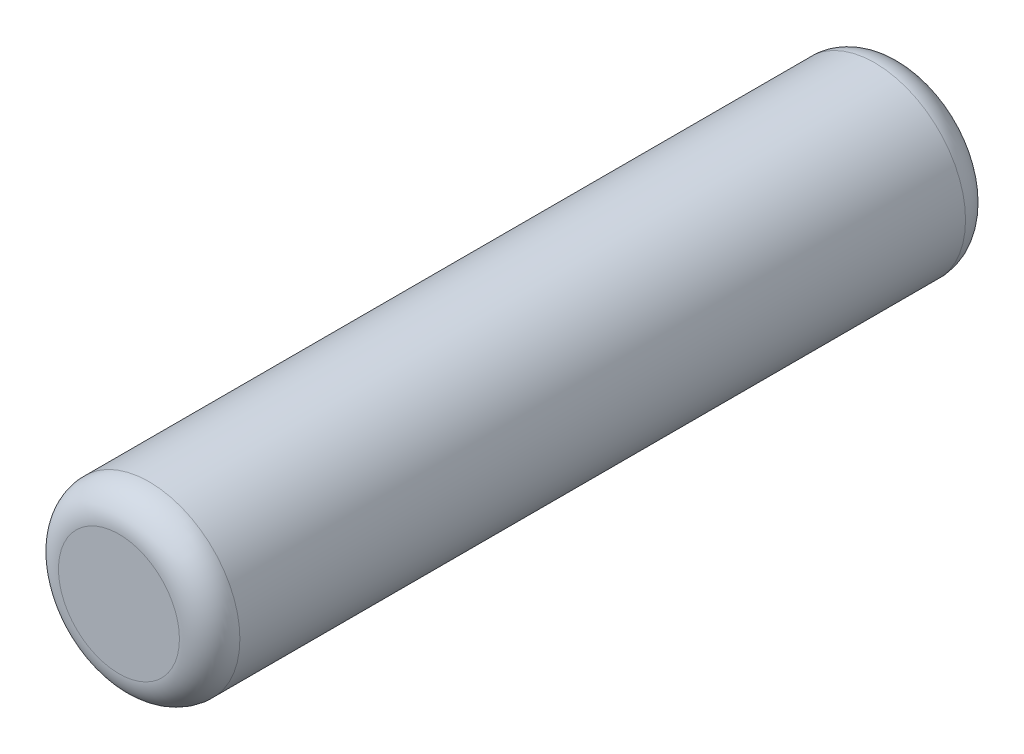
SolidWorks part; units mm, degrees
ref_plane "Спереди" through (0, 0, 0) normal (0, 0, 1) x (1, 0, 0)
ref_plane "Сверху" through (0, 0, 0) normal (0, 1, 0) x (1, 0, 0)
ref_plane "Справа" through (0, 0, 0) normal (1, 0, 0) x (0, 0, -1)
sketch "Эскиз1" plane through (0, 0, 0) normal (0, 0, 1) x (1, 0, 0)
  circle A0 centre (0, 0) radius 1.5
  dimension "D1" = 3
extrude "Бобышка-Вытянуть1" add sketch "Эскиз1" along normal mid plane 13
fillet "Скругление1" radius 0.5 2 edges at (1.5, 0, -6.5) (1.5, 0, 6.5)
